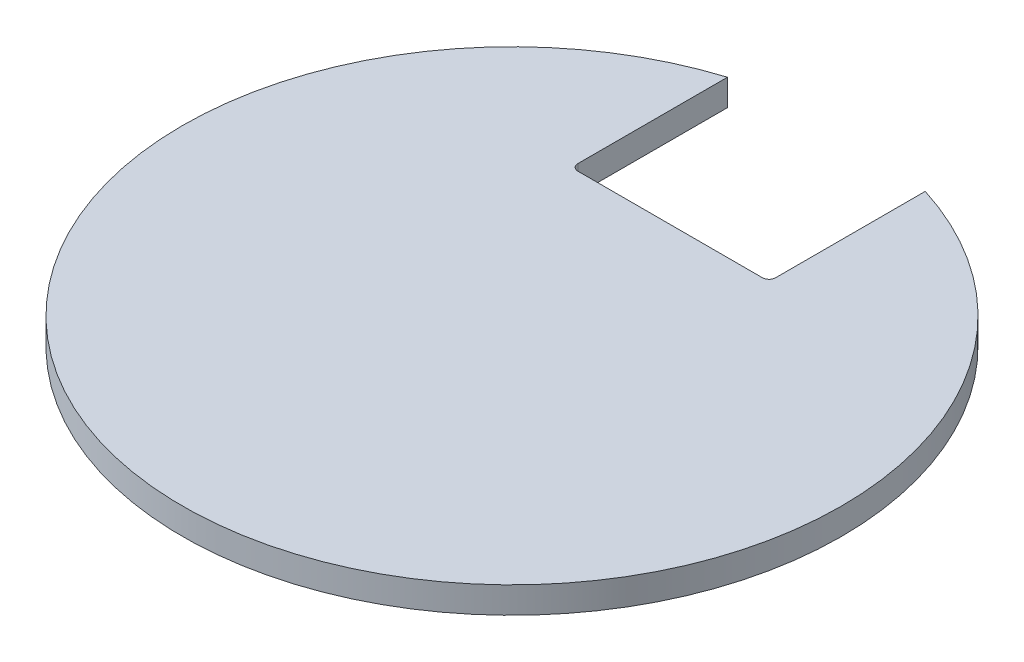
SolidWorks part; units mm, degrees
ref_plane "Płaszczyzna przednia" through (0, 0, 0) normal (0, 0, 1) x (1, 0, 0)
ref_plane "Płaszczyzna górna" through (0, 0, 0) normal (0, 1, 0) x (1, 0, 0)
ref_plane "Płaszczyzna prawa" through (0, 0, 0) normal (1, 0, 0) x (0, 0, -1)
sketch "Szkic1" plane through (0, 0, 0) normal (0, 1, 0) x (1, 0, 0)
  line L129 (22.5298, 3) -> (16.8, 3) construction
  line L130 (15.8, 2) -> (15.8, -8.9) construction
  line L131 (16.8, -9.9) -> (20.2899, -9.9) construction
  line L132 (-22.5298, -3) -> (-16.8, -3) construction
  line L136 (-15.8, -2) -> (-15.8, 12.2844) construction
  line L137 (-15.8, 12.2844) -> (19.5184, 12.2844) construction
  line L138 (22.5298, 3.2) -> (16.8, 3.2)
  line L139 (15.6, 2) -> (15.6, -8.9)
  line L140 (16.8, -10.1) -> (20.2899, -10.1)
  line L141 (-22.5298, -3.2) -> (-16.8, -3.2)
  line L142 (-15.6, -2) -> (-15.6, 11.5844)
  line L143 (-15.1, 12.0844) -> (19.5184, 12.0844)
  line L144 (-15.6, 12.0844) -> (19.5184, 12.0844) construction
  line L145 (-15.6, -2) -> (-15.6, 12.0844) construction
  arc A146 (19.9464, 12.0429) -> (19.5184, 12.2844) centre (19.5184, 11.7844) ccw construction
  arc A147 (23.0238, 3.5768) -> (19.9464, 12.0429) centre (0, 0) ccw construction
  arc A148 (22.5298, 3) -> (23.0238, 3.5768) centre (22.5298, 3.5) ccw construction
  arc A149 (16.8, 3) -> (15.8, 2) centre (16.8, 2) ccw construction
  arc A150 (15.8, -8.9) -> (16.8, -9.9) centre (16.8, -8.9) ccw construction
  arc A151 (20.7349, -10.6281) -> (20.2899, -9.9) centre (20.2899, -10.4) ccw construction
  arc A152 (-23.0238, -3.5768) -> (20.7349, -10.6281) centre (0, 0) ccw construction
  arc A153 (-22.5298, -3) -> (-23.0238, -3.5768) centre (-22.5298, -3.5) ccw construction
  arc A154 (-16.8, -3) -> (-15.8, -2) centre (-16.8, -2) ccw construction
  arc A160 (16.8, 3.2) -> (15.6, 2) centre (16.8, 2) ccw
  arc A161 (15.6, -8.9) -> (16.8, -10.1) centre (16.8, -8.9) ccw
  arc A162 (20.5569, -10.5368) -> (20.2899, -10.1) centre (20.2899, -10.4) ccw
  arc A163 (-22.8262, -3.5461) -> (20.5569, -10.5368) centre (0, 0) ccw
  arc A164 (-22.5298, -3.2) -> (-22.8262, -3.5461) centre (-22.5298, -3.5) ccw
  arc A165 (-16.8, -3.2) -> (-15.6, -2) centre (-16.8, -2) ccw
  arc A166 (19.7752, 11.9395) -> (19.5184, 12.0844) centre (19.5184, 11.7844) ccw
  arc A167 (22.8262, 3.5461) -> (19.7752, 11.9395) centre (0, 0) ccw
  arc A168 (22.5298, 3.2) -> (22.8262, 3.5461) centre (22.5298, 3.5) ccw
  arc A169 (-15.1, 12.0844) -> (-15.6, 11.5844) centre (-15.1, 11.5844) ccw
  dimension "D1" = 0.2
  dimension "D2" = 0.5
sketch "Szkic3" plane through (0, 0, 0) normal (0, -1, 0) x (-1, 0, 0)
  circle A0 centre (0, 0) radius 25
  dimension "D1" = 50
extrude "Dodanie-wyciągnięcie2" add sketch "Szkic3" against normal blind 2
sketch "Szkic4" plane through (0, -0.8, 0) normal (0, 1, 0) x (1, 0, 0)
  circle A0 centre (-9, 0) radius 1.25
  circle A1 centre (9, 0) radius 1.25
  circle A2 centre (9, 0) radius 2.75
  circle A3 centre (-9, 0) radius 2.75
  dimension "D1" = 9
  dimension "D3" = 2.5
  dimension "D4" = 2.5
  dimension "D2" = 9
sketch "Szkic5" plane through (0, 0, 0) normal (0, -1, 0) x (1, 0, 0)
  line L1 (-7.5, -42) -> (7.5, -42)
  line L2 (-7.5, -42) -> (-7.5, -12)
  line L3 (-7.5, -12) -> (7.5, -12)
  line L4 (7.5, -42) -> (7.5, -12)
  line L5 (0, -12) -> (0, -42) construction
  line L6 (-7.5, -27) -> (7.5, -27) construction
  point P0 (0, -26)
  dimension "D1" = 30
  dimension "D2" = 15
  dimension "D4" = 27
extrude "Wytnij-wyciągnięcie1" cut sketch "Szkic5" against normal through all both and the other way through all
chamfer "Sfazowanie7" distance 2.6 angle 45
fillet "Zaokrąglenie1" radius 0.5 2 edges at (7.5, 1, -12) (-7.5, 1, -12)
